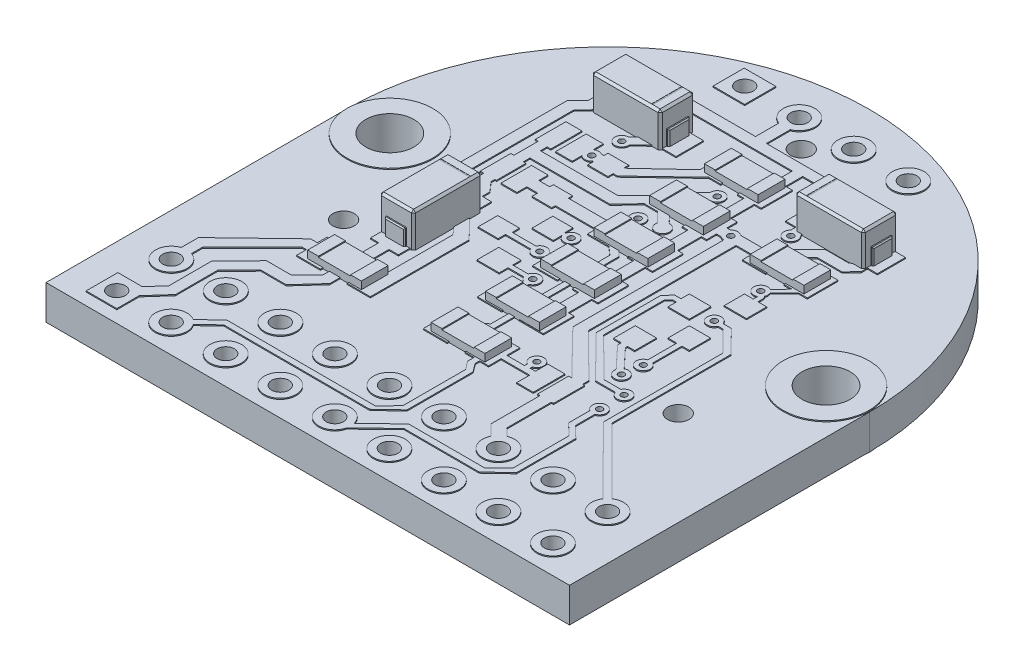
SolidWorks part; units mm, degrees
ref_plane "Front Plane" through (0, 0, 0) normal (0, 0, 1) x (1, 0, 0)
ref_plane "Top Plane" through (0, 0, 0) normal (0, 1, 0) x (1, 0, 0)
ref_plane "Right Plane" through (0, 0, 0) normal (1, 0, 0) x (0, 0, -1)
imported_body "TIV-RMK4-1-solid1"
imported_body "IC-SSOP28-AM4096-1-solid1"
imported_body "IC-SSOP28-AM4096-1-solid2"
imported_body "IC-SSOP28-AM4096-1-solid3"
imported_body "IC-SSOP28-AM4096-1-solid4"
imported_body "IC-SSOP28-AM4096-1-solid5"
imported_body "IC-SSOP28-AM4096-1-solid6"
imported_body "IC-SSOP28-AM4096-1-solid7"
imported_body "IC-SSOP28-AM4096-1-solid8"
imported_body "IC-SSOP28-AM4096-1-solid9"
imported_body "IC-SSOP28-AM4096-1-solid10"
imported_body "IC-SSOP28-AM4096-1-solid11"
imported_body "IC-SSOP28-AM4096-1-solid12"
imported_body "IC-SSOP28-AM4096-1-solid13"
imported_body "IC-SSOP28-AM4096-1-solid14"
imported_body "IC-SSOP28-AM4096-1-solid15"
imported_body "IC-SSOP28-AM4096-1-solid16"
imported_body "IC-SSOP28-AM4096-1-solid17"
imported_body "IC-SSOP28-AM4096-1-solid18"
imported_body "IC-SSOP28-AM4096-1-solid19"
imported_body "IC-SSOP28-AM4096-1-solid20"
imported_body "IC-SSOP28-AM4096-1-solid21"
imported_body "IC-SSOP28-AM4096-1-solid22"
imported_body "IC-SSOP28-AM4096-1-solid23"
imported_body "IC-SSOP28-AM4096-1-solid24"
imported_body "IC-SSOP28-AM4096-1-solid25"
imported_body "IC-SSOP28-AM4096-1-solid26"
imported_body "IC-SSOP28-AM4096-1-solid27"
imported_body "IC-SSOP28-AM4096-1-solid28"
imported_body "IC-SSOP28-AM4096-1-solid29"
imported_body "IC-SSOP28-AM4096-1-solid30"
imported_body "c0805-1-solid1"
imported_body "L0805-1-solid1"
imported_body "r0805-1-solid1"
imported_body "tantal1206-1-solid1"
imported_body "tantal1206-2-solid1"
imported_body "tantal1206-3-solid1"
imported_body "c0805-2-solid1"
imported_body "c0805-3-solid1"
imported_body "c0805-4-solid1"
imported_body "c0805-5-solid1"
imported_body "c0805-6-solid1"
sketch "Sketch1" plane through (0, -1.6, 0) normal (0, -1, 0) x (1, 0, 0)
  circle A0 centre (-22.352, -4.5706) radius 2
  circle A1 centre (-22.352, -4.5706) radius 1.1176
  circle A2 centre (-2.032, -4.5522) radius 2
  circle A3 centre (-2.032, -4.5522) radius 1.1176
  circle A4 centre (-22.352, -4.5706) radius 1.1176 construction
  circle A5 centre (-2.032, -4.5522) radius 1.1176 construction
  dimension "D1" = 4
extrude "Boss-Extrude1" add sketch "Sketch1" along normal up to surface and the other way up to surface
